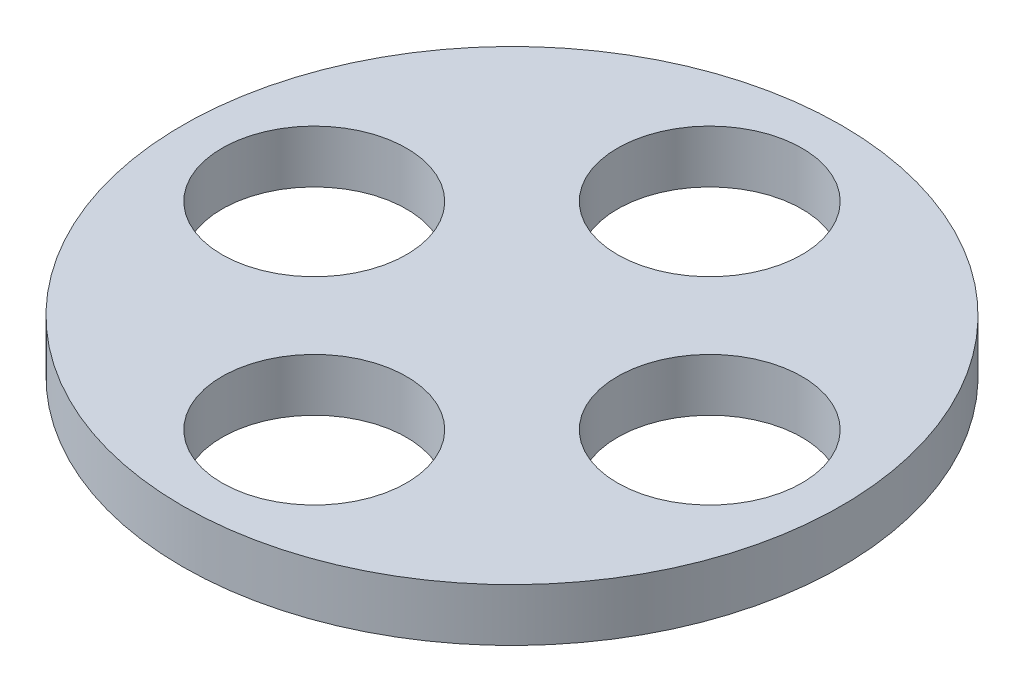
SolidWorks part; units mm, degrees
ref_plane "Front Plane" through (0, 0, 0) normal (0, 0, 1) x (1, 0, 0)
ref_plane "Top Plane" through (0, 0, 0) normal (0, 1, 0) x (1, 0, 0)
ref_plane "Right Plane" through (0, 0, 0) normal (1, 0, 0) x (0, 0, -1)
sketch "Sketch1" plane through (0, 0, 0) normal (0, 1, 0) x (1, 0, 0)
  circle A0 centre (0, 0) radius 125
  point P3 (0, 0)
  dimension "D1" = 250
extrude "Boss-Extrude1" add sketch "Sketch1" along normal blind 20
sketch "Sketch2" plane through (0, 20, 0) normal (0, 1, 0) x (1, 0, 0)
  circle A0 centre (0, 0) radius 75
  circle A1 centre (0, 75) radius 35
  circle A2 centre (75, 0) radius 35
  circle A3 centre (0, -75) radius 35
  circle A4 centre (-75, 0) radius 35
  dimension "D1" = 4
extrude "Cut-Extrude1" cut sketch "Sketch2" against normal through all contours A1 | A4 | A3 | A2
